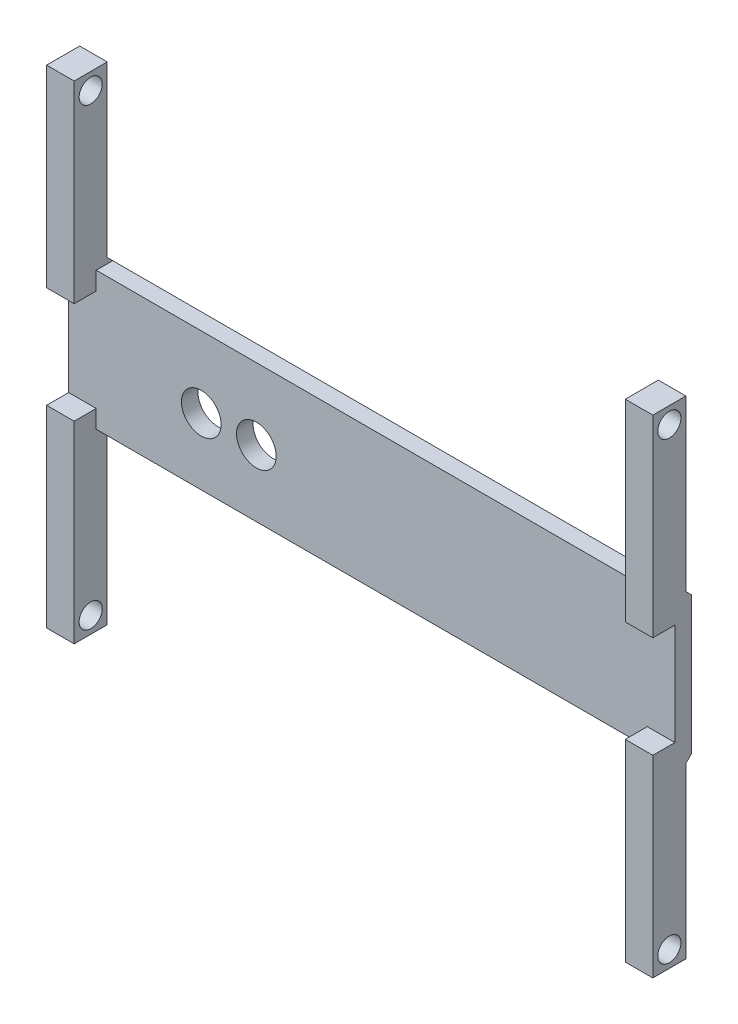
SolidWorks part; units mm, degrees
ref_plane "Front Plane" through (0, 0, 0) normal (0, 0, 1) x (1, 0, 0)
ref_plane "Top Plane" through (0, 0, 0) normal (0, 1, 0) x (1, 0, 0)
ref_plane "Right Plane" through (0, 0, 0) normal (1, 0, 0) x (0, 0, -1)
sketch "Croquis1" plane through (0, 0, 0) normal (0, 0, 1) x (1, 0, 0)
  line L1 (-58, -12.5) -> (58, -12.5)
  line L2 (-58, -12.5) -> (-58, 12.5)
  line L3 (-58, 12.5) -> (58, 12.5)
  line L4 (58, -12.5) -> (58, 12.5)
  line L5 (-58, -12.5) -> (58, 12.5) construction
  line L6 (-58, 12.5) -> (58, -12.5) construction
  point P0 (0, 0)
  dimension "D1" = 116
  dimension "D2" = 25
extrude "Saliente-Extruir1" add sketch "Croquis1" along normal blind 3
sketch "Sketch3" plane through (0, 0, 3) normal (0, 0, 1) x (1, 0, 0)
  line L0 (0, -0.4448) -> (-116.548, -0.4448) construction
  line L1 (58, 12.5) -> (-58, 12.5) construction
  circle A0 centre (-20.939, -0.4448) radius 3.6
  circle A1 centre (-30.939, -0.4448) radius 3.6
  dimension "D1" = 7.2
  dimension "D2" = 7.2
  dimension "D3" = 10
  dimension "D4" = 12.9448
extrude "Cut-Extrude1" cut sketch "Sketch3" against normal blind 5
sketch3d "3DSketch1" plane through (0, 0, 0) normal (0, 0, 1) x (1, 0, 0)
sketch "Sketch6" plane through (58, 0, 0) normal (-1, 0, 0) x (0, 0, 1)
  line L1 (1, -44.2297) -> (7, -44.2297)
  line L2 (7, -44.2297) -> (7, -9.2297)
  line L3 (7, -9.2297) -> (3, -9.2297)
  line L4 (3, 12.5) -> (3, -12.5) construction
  line L6 (0, -12.5) -> (1, -13.5)
  line L7 (0, -12.5) -> (0, -9.2297)
  line L8 (0, 12.5) -> (0, -12.5) construction
  line L9 (0, -9.2297) -> (3, -9.2297)
  line L10 (1, -44.2297) -> (1, -13.5)
  line L11 (3, 0) -> (-241.4066, 0) construction
  line L12 (3, -12.5) -> (3, 12.5) construction
  line L13 (1, 44.2297) -> (1, 13.5)
  line L14 (0, 9.2297) -> (3, 9.2297)
  line L15 (0, 12.5) -> (0, 9.2297)
  line L16 (0, 12.5) -> (1, 13.5)
  line L17 (7, 9.2297) -> (3, 9.2297)
  line L18 (7, 44.2297) -> (7, 9.2297)
  line L19 (1, 44.2297) -> (7, 44.2297)
  dimension "D1" = 6
  dimension "D2" = 35
  dimension "D3" = 18.4595
  dimension "D4" = 135
  dimension "D5" = 1
extrude "Boss-Extrude1" add sketch "Sketch6" along normal blind 8
sketch3d "3DSketch2" plane through (0, 0, 0) normal (0, 0, 1) x (1, 0, 0)
  dimension "D1" = 58
sketch "Sketch7" plane through (-58, 0, 0) normal (-1, 0, 0) x (0, 0, 1)
  line L0 (0, 12.5) -> (1, 13.5)
  line L1 (1, 13.5) -> (1, 44.2297)
  line L2 (1, 44.2297) -> (7, 44.2297)
  line L3 (7, 44.2297) -> (7, 9.2297)
  line L4 (7, 9.2297) -> (3, 9.2297)
  line L5 (3, 9.2297) -> (3, 12.5)
  line L6 (3, 12.5) -> (0, 12.5)
  line L7 (0, 0) -> (32.4148, 0) construction
  line L8 (3, -12.5) -> (0, -12.5)
  line L9 (3, -9.2297) -> (3, -12.5)
  line L10 (7, -9.2297) -> (3, -9.2297)
  line L11 (7, -44.2297) -> (7, -9.2297)
  line L12 (1, -44.2297) -> (7, -44.2297)
  line L13 (1, -13.5) -> (1, -44.2297)
  line L14 (0, -12.5) -> (1, -13.5)
extrude "Boss-Extrude2" add sketch "Sketch7" against normal blind 8
sketch "Sketch10" plane through (-58, 0, 0) normal (-1, 0, 0) x (0, 0, 1)
  line L0 (1, 44.2297) -> (1, 13.5)
  line L1 (1, 13.5) -> (0, 12.5)
  line L2 (0, 12.5) -> (3, 12.5)
  line L3 (3, 12.5) -> (3, 9.2297)
  line L4 (3, 9.2297) -> (7, 9.2297)
  line L5 (7, 9.2297) -> (7, 44.2297)
  line L6 (7, 44.2297) -> (1, 44.2297)
  line L7 (7, -9.2297) -> (7, -44.2297)
  line L8 (7, -44.2297) -> (1, -44.2297)
  line L9 (1, -44.2297) -> (1, -13.5)
  line L10 (1, -13.5) -> (0, -12.5)
  line L11 (0, -12.5) -> (3, -12.5)
  line L12 (3, -12.5) -> (3, -9.2297)
  line L13 (3, -9.2297) -> (7, -9.2297)
extrude "Cut-Extrude2" cut sketch "Sketch10" against normal blind 3
sketch "Sketch11" plane through (58, 0, 0) normal (1, 0, 0) x (0, 0, -1)
  line L0 (-1, 44.2297) -> (-1, 13.5)
  line L1 (-1, 13.5) -> (0, 12.5)
  line L2 (0, 12.5) -> (-3, 12.5)
  line L3 (-3, 12.5) -> (-3, 9.2297)
  line L4 (-3, 9.2297) -> (-7, 9.2297) construction
  line L5 (-3, 9.2297) -> (-7, 9.2297)
  line L6 (-7, 9.2297) -> (-7, 44.2297)
  line L7 (-7, 44.2297) -> (-1, 44.2297)
  line L8 (-7, -9.2297) -> (-7, -44.2297)
  line L9 (-7, -44.2297) -> (-1, -44.2297)
  line L10 (-1, -44.2297) -> (-1, -13.5)
  line L11 (-1, -13.5) -> (0, -12.5)
  line L12 (0, -12.5) -> (-3, -12.5)
  line L13 (-3, -12.5) -> (-3, -9.2297)
  line L14 (-3, -9.2297) -> (-7, -9.2297)
extrude "Cut-Extrude3" cut sketch "Sketch11" against normal blind 3
sketch "Sketch12" plane through (-50, 0, 0) normal (1, 0, 0) x (0, 0, -1)
  line L0 (-4, -44.2297) -> (-4, 44.2297) construction
  line L1 (-7, -44.2297) -> (-1, -44.2297) construction
  line L2 (-1, 44.2297) -> (-7, 44.2297) construction
  circle A0 centre (-4, -41.2297) radius 2.1
  circle A1 centre (-4, 41.2297) radius 2.1
  dimension "D1" = 4.2
  dimension "D2" = 4.2
  dimension "D3" = 3
  dimension "D4" = 3
extrude "Cut-Extrude4" cut sketch "Sketch12" against normal blind 5
sketch "Sketch13" plane through (50, 0, 0) normal (-1, 0, 0) x (0, 0, 1)
  circle A0 centre (4, 41.2297) radius 2.1
  circle A1 centre (4, -41.2297) radius 2.1
  dimension "D1" = 4.2
  dimension "D2" = 4.2
extrude "Cut-Extrude5" cut sketch "Sketch13" against normal blind 5
sketch "Sketch14" plane through (0, 0, 3) normal (0, 0, 1) x (1, 0, 0)
  line L1 (-58, 12.5) -> (-55, 12.5)
  line L2 (-58, 12.5) -> (-58, -12.5)
  line L3 (-58, -12.5) -> (-55, -12.5)
  line L4 (-55, 12.5) -> (-55, -12.5)
  line L5 (55, 12.5) -> (58, 12.5)
  line L6 (55, 12.5) -> (55, -12.5)
  line L7 (55, -12.5) -> (58, -12.5)
  line L8 (58, 12.5) -> (58, -12.5)
extrude "Cut-Extrude6" cut sketch "Sketch14" against normal blind 10
